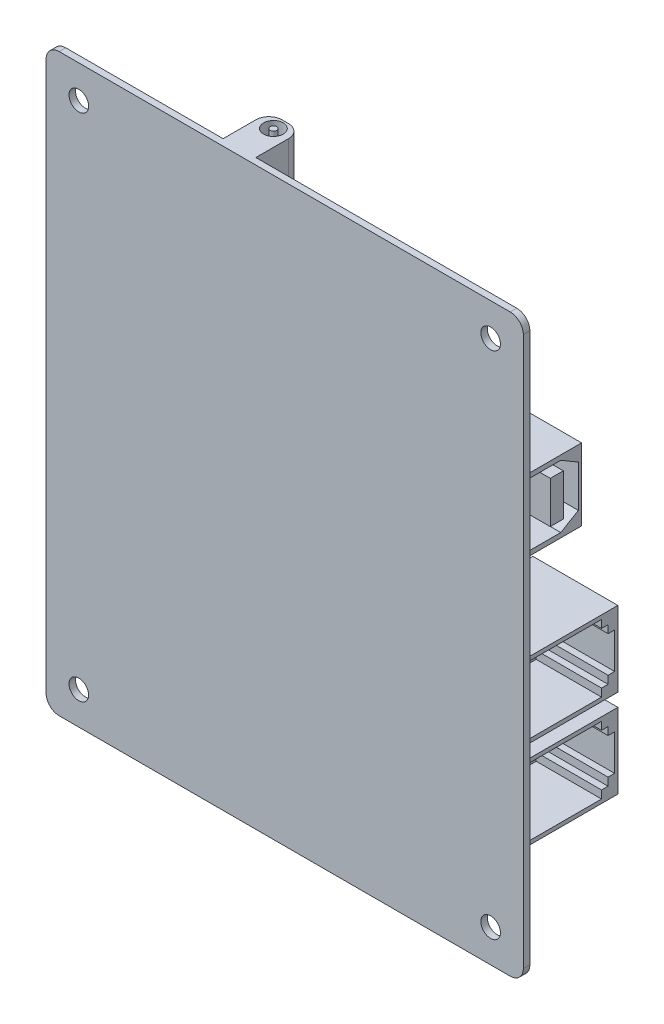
SolidWorks part; units mm, degrees
ref_plane "Plan de face" through (0, 0, 0) normal (0, 0, 1) x (1, 0, 0)
ref_plane "Plan de dessus" through (0, 0, 0) normal (0, 1, 0) x (1, 0, 0)
ref_plane "Plan de droite" through (0, 0, 0) normal (1, 0, 0) x (0, 0, -1)
ref_plane "Plan1" through (-0.2114, 0, 0) normal (-1, 0, 0) x (0, -1, 0)
sketch "Esquisse1" plane through (-0.2114, 0, 0) normal (-1, 0, 0) x (0, -1, 0)
  line L0 (-65.2958, -4) -> (-65.2958, -0.7)
  line L1 (-65.2958, -0.7) -> (-69.2958, -0.7)
  line L2 (-69.2958, -0.7) -> (-69.2958, -4)
  line L3 (-69.2958, -4) -> (-65.2958, -4)
extrude "Boss.-Extru.1" add sketch "Esquisse1" against normal blind 2
sketch "Esquisse2" plane through (1.7886, 0, 0) normal (1, 0, 0) x (0, 0, -1)
  line L0 (4, 69.2958) -> (4, 64.1636)
  line L1 (4, 64.1636) -> (0, 64.1636)
  line L2 (0, 64.1636) -> (0, 69.2958)
  line L3 (0, 69.2958) -> (4, 69.2958)
extrude "Boss.-Extru.2" add sketch "Esquisse2" along normal blind 5.3285
sketch "Esquisse3" plane through (0, 0, -4) normal (0, 0, -1) x (-1, 0, 0)
  line L0 (-7.1171, 69.2958) -> (-1.7886, 69.2958)
  line L1 (-1.7886, 69.2958) -> (-1.7886, 64.1636)
  line L2 (-1.7886, 64.1636) -> (-7.1171, 64.1636)
  line L3 (-7.1171, 64.1636) -> (-7.1171, 69.2958)
extrude "Boss.-Extru.3" add sketch "Esquisse3" along normal blind 1
sketch "Esquisse4" plane through (0, 69.2958, 0) normal (0, 1, 0) x (-1, 0, 0)
  line L0 (-7.1171, -5) -> (-7.1171, 0)
  line L1 (-7.1171, 0) -> (-1.7886, 0)
  line L2 (-1.7886, 0) -> (-1.7886, -5)
  line L3 (-1.7886, -5) -> (-7.1171, -5)
extrude "Boss.-Extru.4" add sketch "Esquisse4" along normal blind 6.8677
ref_plane "Plan2" through (0, 0, 0) normal (0, 0, -1) x (-1, 0, 0)
sketch "Esquisse5" plane through (0, 0, 0) normal (0, 0, -1) x (-1, 0, 0)
  line L0 (0, 88) -> (-73, 88)
  line L1 (-73, 88) -> (-73, 0)
  line L2 (-73, 0) -> (0, 0)
  line L3 (0, 0) -> (0, 88)
extrude "Boss.-Extru.5" add sketch "Esquisse5" against normal blind 1
ref_plane "Plan3" through (0, 0, -0.7) normal (0, 0, 1) x (1, 0, 0)
sketch "Esquisse6" plane through (0, 0, -0.7) normal (0, 0, 1) x (1, 0, 0)
  line L0 (6.7886, 69.2958) -> (6.7886, 73.2958)
  line L1 (6.7886, 73.2958) -> (1.7886, 73.2958)
  line L2 (1.7886, 73.2958) -> (1.7886, 69.2958)
  line L3 (1.7886, 69.2958) -> (6.7886, 69.2958)
extrude "Enlèv. mat.-Extru.1" cut sketch "Esquisse6" against normal blind 3.3
sketch "Esquisse7" plane through (0, 0, 0) normal (0, 0, -1) x (-1, 0, 0)
  line L0 (-56.9156, 54.117) -> (-70.9156, 54.117)
  line L1 (-70.9156, 54.117) -> (-70.9156, 65.117)
  line L2 (-70.9156, 65.117) -> (-56.9156, 65.117)
  line L3 (-56.9156, 65.117) -> (-56.9156, 54.117)
extrude "Boss.-Extru.6" add sketch "Esquisse7" along normal blind 10
sketch "Esquisse8" plane through (70.9156, 0, 0) normal (1, 0, 0) x (0, 0, -1)
  line L0 (0.7985, 64.4032) -> (0.7985, 54.8308)
  line L1 (0.7985, 54.8308) -> (9.5, 54.8308)
  line L2 (9.5, 54.8308) -> (9.5, 64.4032)
  line L3 (9.5, 64.4032) -> (0.7985, 64.4032)
extrude "Enlèv. mat.-Extru.2" cut sketch "Esquisse8" against normal blind 10
sketch "Esquisse9" plane through (60.9156, 0, 0) normal (1, 0, 0) x (0, 0, -1)
  line L0 (7.2047, 62.8162) -> (7.2047, 56.4178)
  line L1 (7.2047, 56.4178) -> (5.2047, 56.4178)
  line L2 (5.2047, 56.4178) -> (5.2047, 62.8162)
  line L3 (5.2047, 62.8162) -> (7.2047, 62.8162)
extrude "Boss.-Extru.7" add sketch "Esquisse9" along normal blind 10
sketch "Esquisse10" plane through (0, 0, 0) normal (0, 0, -1) x (-1, 0, 0)
  line L0 (-15.5805, 3.7363) -> (-21.3805, 3.7363)
  line L1 (-21.3805, 3.7363) -> (-21.3805, 9.5363)
  line L2 (-21.3805, 9.5363) -> (-15.5805, 9.5363)
  line L3 (-15.5805, 9.5363) -> (-15.5805, 3.7363)
extrude "Boss.-Extru.8" add sketch "Esquisse10" along normal blind 2
sketch "Esquisse11" plane through (0, 0, 0) normal (0, 0, -1) x (-1, 0, 0)
  line L0 (-59.466, 30.8581) -> (-72.466, 30.8581)
  line L1 (-72.466, 30.8581) -> (-72.466, 42.3581)
  line L2 (-72.466, 42.3581) -> (-59.466, 42.3581)
  line L3 (-59.466, 42.3581) -> (-59.466, 30.8581)
extrude "Boss.-Extru.9" add sketch "Esquisse11" along normal blind 14
sketch "Esquisse12" plane through (72.466, 0, 0) normal (1, 0, 0) x (0, 0, -1)
  line L0 (13.5, 39.3581) -> (12.5, 39.3581)
  line L1 (12.5, 39.3581) -> (12.5, 40.5581)
  line L2 (12.5, 40.5581) -> (11.5, 40.5581)
  line L3 (11.5, 40.5581) -> (11.5, 41.7581)
  line L4 (11.5, 41.7581) -> (0.5, 41.7581)
  line L5 (0.5, 41.7581) -> (0.5, 31.4581)
  line L6 (0.5, 31.4581) -> (11.5, 31.4581)
  line L7 (11.5, 31.4581) -> (11.5, 32.6581)
  line L8 (11.5, 32.6581) -> (12.5, 32.6581)
  line L9 (12.5, 32.6581) -> (12.5, 33.8581)
  line L10 (12.5, 33.8581) -> (13.5, 33.8581)
  line L11 (13.5, 33.8581) -> (13.5, 39.3581)
extrude "Enlèv. mat.-Extru.3" cut sketch "Esquisse12" against normal blind 10
sketch "Esquisse13" plane through (0, 0, 0) normal (0, 0, -1) x (-1, 0, 0)
  line L0 (-72.466, 28.8581) -> (-59.466, 28.8581)
  line L1 (-59.466, 28.8581) -> (-59.466, 17.3581)
  line L2 (-59.466, 17.3581) -> (-72.466, 17.3581)
  line L3 (-72.466, 17.3581) -> (-72.466, 28.8581)
extrude "Boss.-Extru.10" add sketch "Esquisse13" along normal blind 14
sketch "Esquisse14" plane through (72.466, 0, 0) normal (1, 0, 0) x (0, 0, -1)
  line L0 (13.5, 25.8581) -> (12.5, 25.8581)
  line L1 (12.5, 25.8581) -> (12.5, 27.0581)
  line L2 (12.5, 27.0581) -> (11.5, 27.0581)
  line L3 (11.5, 27.0581) -> (11.5, 28.2581)
  line L4 (11.5, 28.2581) -> (0.5, 28.2581)
  line L5 (0.5, 28.2581) -> (0.5, 17.9581)
  line L6 (0.5, 17.9581) -> (11.5, 17.9581)
  line L7 (11.5, 17.9581) -> (11.5, 19.1581)
  line L8 (11.5, 19.1581) -> (12.5, 19.1581)
  line L9 (12.5, 19.1581) -> (12.5, 20.3581)
  line L10 (12.5, 20.3581) -> (13.5, 20.3581)
  line L11 (13.5, 20.3581) -> (13.5, 25.8581)
extrude "Enlèv. mat.-Extru.4" cut sketch "Esquisse14" against normal blind 10
sketch "Esquisse15" plane through (0, 0, 0) normal (0, 0, -1) x (-1, 0, 0)
  line L0 (-14.8167, 42.3581) -> (-1.8167, 42.3581)
  line L1 (-1.8167, 42.3581) -> (-1.8167, 30.8581)
  line L2 (-1.8167, 30.8581) -> (-14.8167, 30.8581)
  line L3 (-14.8167, 30.8581) -> (-14.8167, 42.3581)
extrude "Boss.-Extru.11" add sketch "Esquisse15" along normal blind 14
sketch "Esquisse16" plane through (1.8167, 0, 0) normal (-1, 0, 0) x (0, 0, 1)
  line L0 (-11.5, 40.5581) -> (-12.5, 40.5581)
  line L1 (-12.5, 40.5581) -> (-12.5, 39.3581)
  line L2 (-12.5, 39.3581) -> (-13.5, 39.3581)
  line L3 (-13.5, 39.3581) -> (-13.5, 33.8581)
  line L4 (-13.5, 33.8581) -> (-12.5, 33.8581)
  line L5 (-12.5, 33.8581) -> (-12.5, 32.6581)
  line L6 (-12.5, 32.6581) -> (-11.5, 32.6581)
  line L7 (-11.5, 32.6581) -> (-11.5, 31.4581)
  line L8 (-11.5, 31.4581) -> (-0.5, 31.4581)
  line L9 (-0.5, 31.4581) -> (-0.5, 41.7581)
  line L10 (-0.5, 41.7581) -> (-11.5, 41.7581)
  line L11 (-11.5, 41.7581) -> (-11.5, 40.5581)
extrude "Enlèv. mat.-Extru.5" cut sketch "Esquisse16" against normal blind 10
sketch "Esquisse17" plane through (0, 0, 0) normal (0, 0, -1) x (-1, 0, 0)
  line L0 (-14.8167, 28.8581) -> (-1.8167, 28.8581)
  line L1 (-1.8167, 28.8581) -> (-1.8167, 17.3581)
  line L2 (-1.8167, 17.3581) -> (-14.8167, 17.3581)
  line L3 (-14.8167, 17.3581) -> (-14.8167, 28.8581)
extrude "Boss.-Extru.12" add sketch "Esquisse17" along normal blind 14
sketch "Esquisse18" plane through (1.8167, 0, 0) normal (-1, 0, 0) x (0, 0, 1)
  line L0 (-13.5, 20.3581) -> (-12.5, 20.3581)
  line L1 (-12.5, 20.3581) -> (-12.5, 19.1581)
  line L2 (-12.5, 19.1581) -> (-11.5, 19.1581)
  line L3 (-11.5, 19.1581) -> (-11.5, 17.9581)
  line L4 (-11.5, 17.9581) -> (-0.5, 17.9581)
  line L5 (-0.5, 17.9581) -> (-0.5, 28.2581)
  line L6 (-0.5, 28.2581) -> (-11.5, 28.2581)
  line L7 (-11.5, 28.2581) -> (-11.5, 27.0581)
  line L8 (-11.5, 27.0581) -> (-12.5, 27.0581)
  line L9 (-12.5, 27.0581) -> (-12.5, 25.8581)
  line L10 (-12.5, 25.8581) -> (-13.5, 25.8581)
  line L11 (-13.5, 25.8581) -> (-13.5, 20.3581)
extrude "Enlèv. mat.-Extru.6" cut sketch "Esquisse18" against normal blind 10
sketch "Esquisse19" plane through (0, 0, 0) normal (0, 0, -1) x (-1, 0, 0)
  line L0 (-26.0769, 75.6678) -> (-31.0769, 75.6678)
  line L1 (-31.0769, 75.6678) -> (-31.0769, 88)
  line L2 (-31.0769, 88) -> (-26.0769, 88)
  line L3 (-26.0769, 88) -> (-26.0769, 75.6678)
extrude "Boss.-Extru.13" add sketch "Esquisse19" along normal blind 7
hole_wizard "Diamètre du perçage Ø3.0 (3)1" positions "Esquisse21" profile "Esquisse20" hole size "Ø3.0" standard "Ansi Metric"
sketch "Esquisse21" plane through (0, 88, 0) normal (0, 1, 0) x (1, 0, 0)
  point P0 (28.5769, 5.1955)
sketch "Esquisse20" plane through (28.5769, 88, -5.1955) normal (1, 0, 0) x (0, 0, 1)
  line L0 (0, 0) -> (0, 8)
  line L1 (0, 8) -> (1.5, 8)
  line L2 (1.5, 8) -> (1.5, 0)
  line L5 (1.5, 0) -> (0, 0)
  line L10 (0, 8) -> (-1.5, 8) construction
  line L11 (0, -6.35) -> (0, 107.95) construction
  dimension "Diamètre du perçage" = 3
  dimension "Profondeur du perçage" = 8
  dimension "Angle de pointe" = 180
ref_plane "Plan4" through (0, 6.6191, 0) normal (0, 1, 0) x (1, 0, 0)
sketch "Esquisse22" plane through (0, 6.6191, 0) normal (0, 1, 0) x (1, 0, 0)
  line L0 (61.345, 7) -> (57.345, 7)
  line L1 (57.345, 7) -> (57.345, 0)
  line L2 (57.345, 0) -> (61.345, 0)
  line L3 (61.345, 0) -> (61.345, 7)
  line L4 (57.345, 7) -> (57.345, 0) construction
revolve "Révolution1" add sketch "Esquisse22" angle 360 about L4
ref_plane "Plan5" through (0, 0, -5.1955) normal (0, 0, -1) x (-1, 0, 0)
sketch "Esquisse23" plane through (0, 0, -5.1955) normal (0, 0, -1) x (-1, 0, 0)
  line L0 (-29.0769, 80) -> (-28.5769, 80)
  line L1 (-28.5769, 80) -> (-28.5769, 88)
  line L2 (-28.5769, 88) -> (-29.0769, 88)
  line L3 (-29.0769, 88) -> (-29.0769, 80)
  line L4 (-28.5769, 80) -> (-28.5769, 88) construction
revolve "Révolution2" add sketch "Esquisse23" angle 360 about L4
ref_plane "Plan6" through (0, 6.7134, 0) normal (0, 1, 0) x (1, 0, 0)
sketch "Esquisse24" plane through (0, 6.7134, 0) normal (0, 1, 0) x (1, 0, 0)
  line L0 (19.9305, 3) -> (18.4305, 3)
  line L1 (18.4305, 3) -> (18.4305, 2)
  line L2 (18.4305, 2) -> (19.9305, 2)
  line L3 (19.9305, 2) -> (19.9305, 3)
  line L4 (18.4305, 3) -> (18.4305, 2) construction
revolve "Révolution3" add sketch "Esquisse24" angle 360 about L4
hole_wizard "Diamètre du perçage Ø3.0 (3)2" positions "Esquisse26" profile "Esquisse25" hole size "Ø3.0" standard "Ansi Metric"
sketch "Esquisse26" plane through (0, 0, 1) normal (0, 0, 1) x (1, 0, 0)
  point P0 (68, 5)
  point P1 (5, 83)
  point P2 (5, 5)
  point P3 (68, 83)
sketch "Esquisse25" plane through (68, 5, 1) normal (1, 0, 0) x (0, -1, 0)
  line L0 (0, 0) -> (0, 15)
  line L1 (0, 15) -> (1.5, 15)
  line L2 (1.5, 15) -> (1.5, 0)
  line L5 (1.5, 0) -> (0, 0)
  line L11 (0, -6.35) -> (0, 107.95) construction
  dimension "Diamètre du perçage jusqu'au prochain" = 3
  dimension "Profondeur du perçage jusqu'au prochain" = 15
hole_wizard "Diamètre du perçage Ø2.0 (2)1" positions "Esquisse28" profile "Esquisse27" hole size "Ø2.0" standard "Ansi Metric"
sketch "Esquisse28" plane through (0, 0, -7) normal (0, 0, -1) x (-1, 0, 0)
  point P0 (-57.345, 6.6191)
sketch "Esquisse27" plane through (57.345, 6.6191, -7) normal (1, 0, 0) x (0, 1, 0)
  line L0 (0, 0) -> (0, 7)
  line L1 (0, 7) -> (1, 7)
  line L2 (1, 7) -> (1, 0)
  line L5 (1, 0) -> (0, 0)
  line L10 (0, 7) -> (-1, 7) construction
  line L11 (0, -6.35) -> (0, 107.95) construction
  dimension "Diamètre du perçage" = 2
  dimension "Profondeur du perçage" = 7
  dimension "Angle de pointe" = 180
chamfer "Chanfrein1" distance 1.587 angle 59.411 1 edges at (65.9156, 54.8308, -9.5)
chamfer "Chanfrein2" distance 2.6847 angle 30.589 1 edges at (65.9156, 64.4032, -9.5)
fillet "Congé1" radius 2 6 edges at (73, 0, 0.5) (0, 88, 0.5) (0, 0, 0.5) (26.0769, 81.8339, -7) (73, 88, 0.5) (31.0769, 81.8339, -7)
